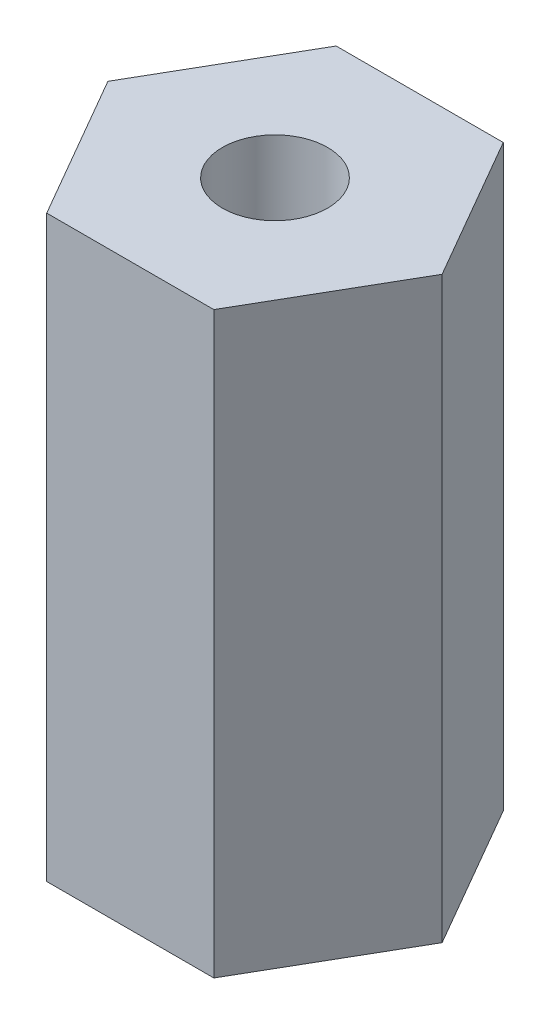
SolidWorks part; units mm, degrees
ref_plane "Alzado" through (0, 0, 0) normal (0, 0, 1) x (1, 0, 0)
ref_plane "Planta" through (0, 0, 0) normal (0, 1, 0) x (1, 0, 0)
ref_plane "Vista lateral" through (0, 0, 0) normal (1, 0, 0) x (0, 0, -1)
sketch "Croquis1" plane through (0, 0, 0) normal (0, 1, 0) x (1, 0, 0)
  line L1 (1.5877, 2.75) -> (-1.5877, 2.75)
  line L2 (-1.5877, 2.75) -> (-3.1754, 0)
  line L3 (-3.1754, 0) -> (-1.5877, -2.75)
  line L4 (-1.5877, -2.75) -> (1.5877, -2.75)
  line L5 (1.5877, -2.75) -> (3.1754, 0)
  line L6 (3.1754, 0) -> (1.5877, 2.75)
  circle A0 centre (0, 0) radius 2.75 construction
  dimension "D1" = 5.5
extrude "Saliente-Extruir1" add sketch "Croquis1" along normal blind 11
sketch "Croquis2" plane through (0, 11, 0) normal (0, 1, 0) x (1, 0, 0)
  circle A0 centre (0, 0) radius 1
  dimension "D1" = 2
extrude "Cortar-Extruir1" cut sketch "Croquis2" against normal through all
